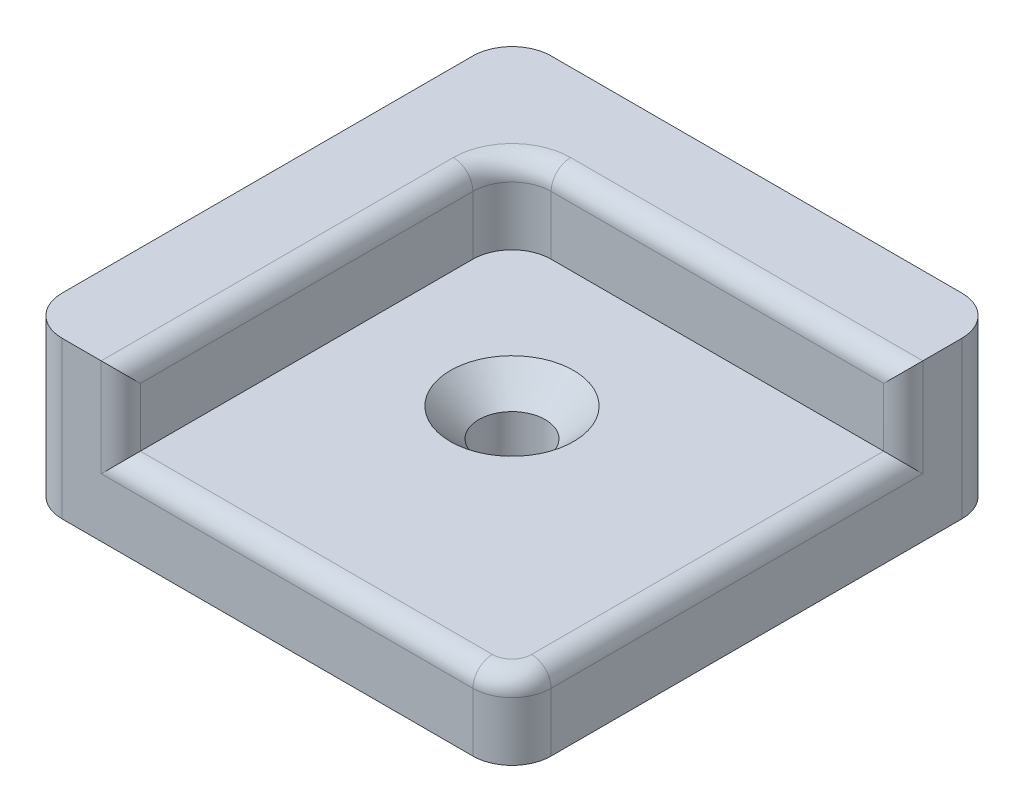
SolidWorks part; units mm, degrees
ref_plane "Front Plane" through (0, 0, 0) normal (0, 0, 1) x (1, 0, 0)
ref_plane "Top Plane" through (0, 0, 0) normal (0, 1, 0) x (1, 0, 0)
ref_plane "Right Plane" through (0, 0, 0) normal (1, 0, 0) x (0, 0, -1)
sketch "Sketch2" plane through (0, 0, 0) normal (0, 1, 0) x (1, 0, 0)
  line L1 (-12.5, -12.5) -> (12.5, -12.5)
  line L2 (-12.5, -12.5) -> (-12.5, 12.5)
  line L3 (-12.5, 12.5) -> (12.5, 12.5)
  line L4 (12.5, -12.5) -> (12.5, 12.5)
  line L5 (-12.5, -12.5) -> (12.5, 12.5) construction
  line L6 (-12.5, 12.5) -> (12.5, -12.5) construction
  point P0 (0, 0)
  dimension "D1" = 25
extrude "Boss-Extrude1" add sketch "Sketch2" along normal mid plane 8
sketch "Sketch3" plane through (0, 4, 0) normal (0, 1, 0) x (1, 0, 0)
  line L0 (-7.5, -12.5) -> (-7.5, 5.5)
  line L1 (-12.5, -12.5) -> (12.5, -12.5) construction
  line L2 (-5.5, 7.5) -> (12.5, 7.5)
  line L3 (12.5, -12.5) -> (12.5, 12.5) construction
  line L4 (12.5, 7.5) -> (12.5, -12.5)
  line L5 (12.5, -12.5) -> (-7.5, -12.5)
  arc A0 (-7.5, 5.5) -> (-5.5, 7.5) centre (-5.5, 5.5) cw
  dimension "D1" = 5
  dimension "D3" = 2
  dimension "D2" = 5
extrude "Cut-Extrude1" cut sketch "Sketch3" against normal blind 4
fillet "Fillet2" radius 2 4 edges at (-12.5, 0, -12.5) (12.5, 0, -12.5) (-12.5, 0, 12.5) (12.5, -2, 12.5)
fillet "Fillet4" radius 1 8 edges at (3.5, 4, -7.5) (-6.9142, 4, -6.9142) (12.5, 0, 1.5) (11.9142, 0, 11.9142) (-7.5, 4, 3.5) (12.5, 2, -7.5) (1.5, 0, 12.5) (-7.5, 2, 12.5)
hole_wizard "CSK for M3 Countersunk Flat Head Screw1" positions "Sketch4" profile "Sketch5" countersink size "M3" standard "ISO"
sketch "Sketch4" plane through (0, 0, 0) normal (0, 1, 0) x (1, 0, 0)
  point P0 (0, 0)
sketch "Sketch5" plane through (0, 0, 0) normal (1, 0, 0) x (0, 0, 1)
  line L0 (0, 0) -> (0, 4)
  line L1 (0, 4) -> (1.7, 4)
  line L2 (1.7, 4) -> (1.7, 1.45)
  line L3 (1.7, 1.45) -> (3.15, 0)
  line L5 (3.15, 0) -> (0, 0)
  line L6 (-1.7, 1.45) -> (-3.15, 0) construction
  line L11 (0, -6.35) -> (0, 107.95) construction
  dimension "Thru Hole Dia." = 3.4
  dimension "Thru Hole Depth" = 4
  dimension "Near C'Sink Dia." = 6.3
  dimension "Near C'Sink Angle" = 90
